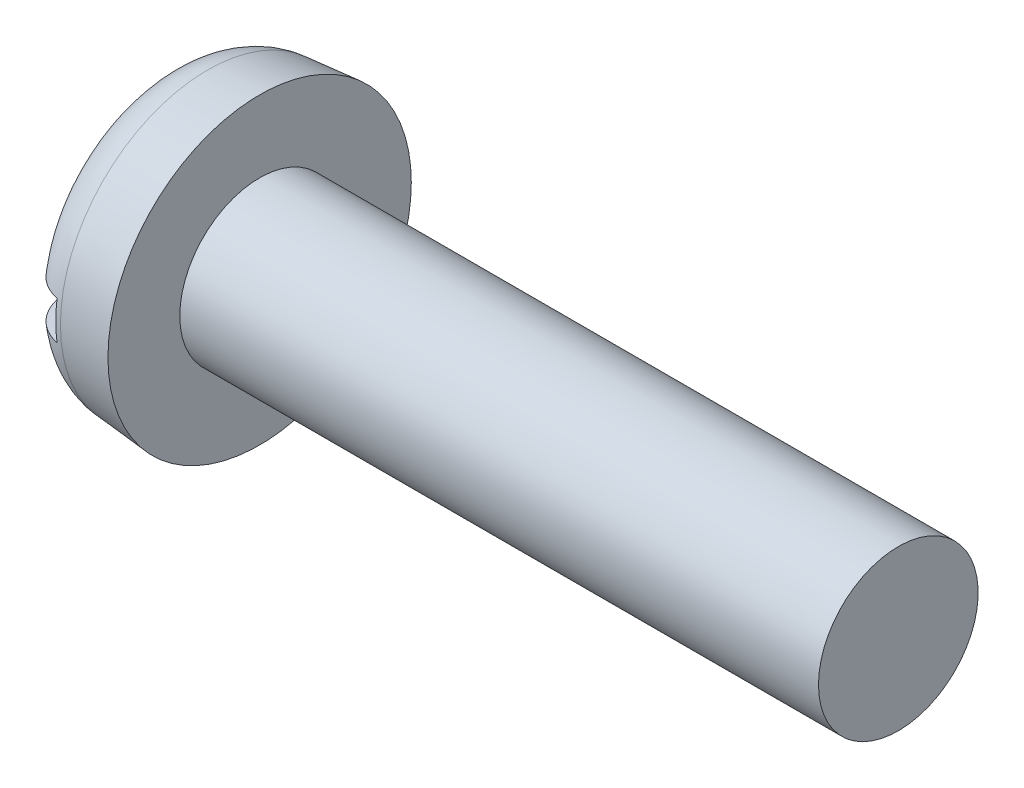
SolidWorks part; units mm, degrees
ref_plane "Plane1" through (0, 0, 0) normal (0, 0, 1) x (1, 0, 0)
ref_plane "Plane2" through (0, 0, 0) normal (0, 1, 0) x (1, 0, 0)
ref_plane "Plane3" through (0, 0, 0) normal (1, 0, 0) x (0, 0, -1)
sketch "BodySke" plane through (0, 0, 0) normal (0, 0, 1) x (1, 0, 0)
  line L0 (3, 2.5) -> (3, 4.75)
  line L1 (0, 0) -> (0, 4.4875)
  line L2 (-25.4, 0) -> (127, 0) construction
  line L3 (23, 0) -> (0, 0)
  line L4 (3, 2.5) -> (23, 2.5)
  line L5 (23, 2.5) -> (23, 0)
  line L6 (0, 4.4875) -> (3, 4.75)
  line L9 (3.8, 4.0875) -> (3.8, -5.4375) construction
  line L10 (3, 6.35) -> (3, -3.175) construction
  dimension "Head_ht" = 3
  dimension "Diameter" = 5
  dimension "Length" = 20
  dimension "Head_dia" = 9.5
  dimension "Advance" = 0.8
  dimension "Thread_nom" = 20
  dimension "Head_side_angle" = 5
revolve "Base-Revolve" add sketch "BodySke"
fillet "Fillet1" [suppressed] radius 0.2
fillet "Fillet2" radius 1.5 1 edges at (0, 0, 4.4875)
sketch "Sketch2" plane through (0, 0, 0) normal (1, 0, 0) x (0, 0, -1)
  line L0 (4.75, -0.6) -> (-4.75, -0.6)
  line L1 (4.75, -0.6) -> (4.75, 0.6)
  line L2 (-4.75, 0.6) -> (4.75, 0.6)
  line L3 (-4.75, 0.6) -> (-4.75, -0.6)
  dimension "D1" = 9.5
  dimension "D2" = 4.75
  dimension "Slot_width" = 1.2
  dimension "D3" = 0.6
extrude "Slot" cut sketch "Sketch2" along normal blind 1.2
sketch "ThdSchSke" plane through (0, 0, 0) normal (0, 0, 1) x (1, 0, 0)
  line L0 (4.6, -2.055) -> (4.2884, -2.5)
  line L1 (4.6, -2.055) -> (4.9116, -2.5)
  line L2 (4.9116, -2.5) -> (4.9116, -3.125)
  line L3 (-3.175, 0) -> (5.1513, 0) construction
  line L5 (4.9116, -3.125) -> (4.2884, -3.125)
  line L6 (4.2884, -3.125) -> (4.2884, -2.5)
  dimension "Thread_minor" = 4.11
  dimension "Diameter" = 5
  dimension "Start" = 4.6
  dimension "SideAngle" = 55
  dimension "VeeAngle" = 70
  dimension "Overcut" = 6.25
revolve "ThreadSchematic" [suppressed] cut sketch "ThdSchSke" angle 360 about L3
pattern_linear "ThdSchPat" [suppressed]
equation "\"D1@Sketch2\" = \"Head_dia@BodySke\""
equation "\"D2@Sketch2\" = \"D1@Sketch2\" / 2"
equation "\"D3@Sketch2\" = \"Slot_width@Sketch2\" / 2"
equation "\"Thread_length@ThreadCosmetic\" = ((sgn( (\"Length@BodySke\" - \"Advance@BodySke\" * 2.0 ) - \"Thread_nom@BodySke\" )-1)*( (\"Length@BodySke\" - \"Advance@BodySke\"  * 2.0) - \"Thread_nom@BodySke\" ))/-2+ \"Thread_"
equation "\"Thread_minor@ThdSchSke\" = \"Thread_minor@ThreadCosmetic\""
equation "\"Diameter@ThdSchSke\" = \"Diameter@BodySke\""
equation "\"Overcut@ThdSchSke\" = \"Diameter@BodySke\" * 1.25"
equation "\"Start@ThdSchSke\" = \"Head_ht@BodySke\" + \"Length@BodySke\" - \"Thread_length@ThreadCosmetic\"  '---Non-countersunk---"
equation "\"Num_threads@ThdSchPat\" = int( \"Thread_length@ThreadCosmetic\" / \"Advance@BodySke\" + 0.999 )  + 1"
equation "\"Advance@ThdSchPat\" = \"Thread_length@ThreadCosmetic\" /  (\"Num_threads@ThdSchPat\" - 1) 'relax it"
